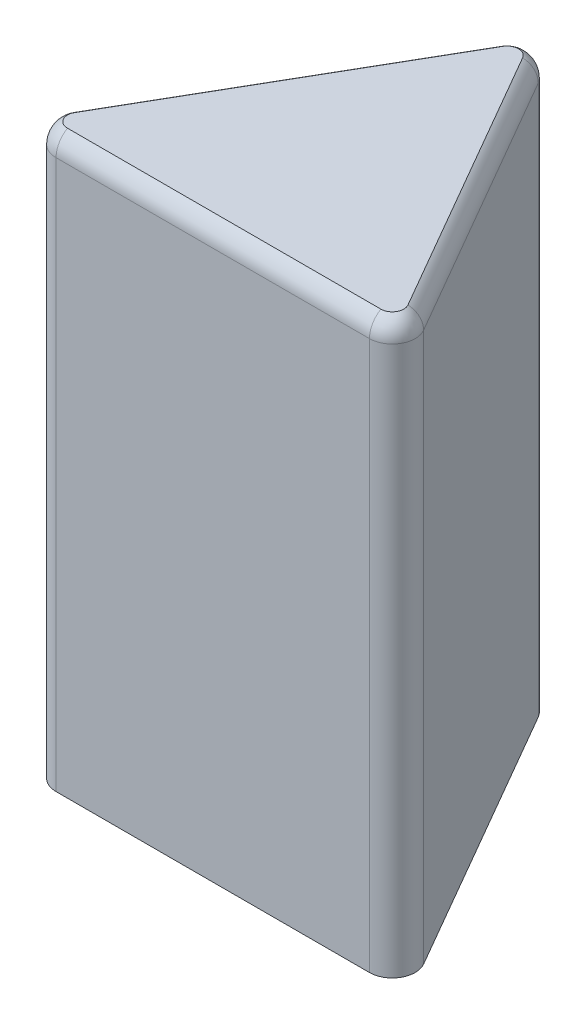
SolidWorks part; units mm, degrees
ref_plane "Alzado" through (0, 0, 0) normal (0, 0, 1) x (1, 0, 0)
ref_plane "Planta" through (0, 0, 0) normal (0, 1, 0) x (1, 0, 0)
ref_plane "Vista lateral" through (0, 0, 0) normal (1, 0, 0) x (0, 0, -1)
sketch "Croquis1" plane through (0, 0, 0) normal (0, 1, 0) x (1, 0, 0)
  line L1 (-1.55, 3.7417) -> (-1.55, 5.15)
  line L2 (-4.05, -4.05) -> (4.05, -4.05) construction
  line L3 (-0.866, 8.4097) -> (-7.716, -3.4548)
  line L4 (-6.85, -4.9548) -> (6.85, -4.9548)
  line L5 (0.866, 8.4097) -> (7.716, -3.4548)
  line L6 (-4.05, -4.05) -> (-4.05, 4.05) construction
  line L7 (-4.05, 4.05) -> (-1.55, 4.05) construction
  line L8 (4.05, -4.05) -> (4.05, 4.05) construction
  line L9 (-4.05, -4.05) -> (4.05, 4.05) construction
  line L10 (-4.05, 4.05) -> (4.05, -4.05) construction
  line L11 (-1.55, 5.15) -> (1.55, 5.15)
  line L12 (1.55, 5.15) -> (1.55, 3.7417)
  line L13 (0, 5.15) -> (0, 0) construction
  line L14 (-1.55, 4.05) -> (0, 4.05) construction
  line L15 (1.55, 4.05) -> (4.05, 4.05) construction
  line L16 (0, 4.05) -> (1.55, 4.05) construction
  circle A0 centre (0, 0) radius 9.468 construction
  arc A1 (-7.716, -3.4548) -> (-6.85, -4.9548) centre (-6.85, -3.9548) ccw
  arc A2 (0.866, 8.4097) -> (-0.866, 8.4097) centre (0, 7.9097) ccw
  arc A3 (6.85, -4.9548) -> (7.716, -3.4548) centre (6.85, -3.9548) ccw
  arc A4 (-1.55, 3.7417) -> (1.55, 3.7417) centre (0, 0) ccw
  arc A5 (2.8638, 2.8638) -> (1.55, 3.7417) centre (0, 0) ccw construction
  arc A6 (-1.55, 3.7417) -> (-2.8638, 2.8638) centre (0, 0) ccw construction
  arc A7 (-4.0115, 0.5569) -> (2.8638, 2.8638) centre (0, 0) ccw construction
  arc A8 (-2.8638, 2.8638) -> (-4.0115, 0.5569) centre (0, 0) ccw construction
  arc A9 (0, 4.05) -> (-1.55, 3.7417) centre (0, 0) ccw construction
  arc A10 (0, 4.05) -> (-1.55, 3.7417) centre (0, 0) ccw construction
  arc A11 (1.55, 3.7417) -> (0, 4.05) centre (0, 0) ccw construction
  arc A12 (1.55, 3.7417) -> (0, 4.05) centre (0, 0) ccw construction
  point P18 (0, 0)
  dimension "D2" = 1
  dimension "D3" = 13.7
  dimension "D1" = 3
  dimension "D4" = 8.1
  dimension "D5" = 9.2
  dimension "D6" = 3.1
extrude "Saliente-Extruir1" add sketch "Croquis1" along normal blind 25
chamfer "Chaflán1" distance 0.5 angle 45 4 edges at (0, 0, 4.05) (1.55, 0, -4.4458) (0, 0, -5.15) (-1.55, 0, -4.4458)
fillet "Redondeo1" radius 1 6 edges at (-7.716, 25, 4.4548) (-4.291, 25, -2.4774) (0, 25, -8.9097) (4.291, 25, -2.4774) (7.716, 25, 4.4548) (0, 25, 4.9548)
sketch "Croquis2" plane through (0, 25, 0) normal (0, 1, 0) x (1, 0, 0)
  line L19 (-6.85, -4.4548) -> (6.85, -4.4548)
  line L20 (-0.433, 8.1597) -> (-7.283, -3.7048)
  line L21 (7.283, -3.7048) -> (0.433, 8.1597)
  line L22 (-6.85, -4.4548) -> (6.85, -4.4548)
  line L23 (-0.433, 8.1597) -> (-7.283, -3.7048)
  line L24 (7.283, -3.7048) -> (0.433, 8.1597)
  arc A15 (-7.283, -3.7048) -> (-6.85, -4.4548) centre (-6.85, -3.9548) ccw
  arc A16 (6.85, -4.4548) -> (7.283, -3.7048) centre (6.85, -3.9548) ccw
  arc A17 (0.433, 8.1597) -> (-0.433, 8.1597) centre (0, 7.9097) ccw
  arc A18 (-7.283, -3.7048) -> (-6.85, -4.4548) centre (-6.85, -3.9548) ccw
  arc A19 (6.85, -4.4548) -> (7.283, -3.7048) centre (6.85, -3.9548) ccw
  arc A20 (0.433, 8.1597) -> (-0.433, 8.1597) centre (0, 7.9097) ccw
  dimension "D1" = 0.5
extrude "Saliente-Extruir2" add sketch "Croquis2" against normal blind 3
sketch "Croquis3" plane through (0, 25, 0) normal (0, 1, 0) x (1, 0, 0)
  circle A0 centre (0, 0) radius 2.475
  dimension "D1" = 4.95
extrude "Saliente-Extruir3" [suppressed] add sketch "Croquis3" along normal blind 3
fillet "Redondeo2" [suppressed] radius 2
sketch "Croquis4" plane through (0, 25, 0) normal (0, 1, 0) x (1, 0, 0)
  line L3 (-6.85, -4.4548) -> (6.85, -4.4548)
  line L4 (7.283, -3.7048) -> (0.433, 8.1597)
  line L5 (-0.433, 8.1597) -> (-7.283, -3.7048)
  line L6 (-6.85, -4.4548) -> (6.85, -4.4548)
  line L7 (7.283, -3.7048) -> (0.433, 8.1597)
  line L8 (-0.433, 8.1597) -> (-7.283, -3.7048)
  arc A3 (-7.283, -3.7048) -> (-6.85, -4.4548) centre (-6.85, -3.9548) ccw
  arc A4 (6.85, -4.4548) -> (7.283, -3.7048) centre (6.85, -3.9548) ccw
  arc A5 (0.433, 8.1597) -> (-0.433, 8.1597) centre (0, 7.9097) ccw
  arc A6 (-7.283, -3.7048) -> (-6.85, -4.4548) centre (-6.85, -3.9548) ccw
  arc A7 (6.85, -4.4548) -> (7.283, -3.7048) centre (6.85, -3.9548) ccw
  arc A8 (0.433, 8.1597) -> (-0.433, 8.1597) centre (0, 7.9097) ccw
  dimension "D1" = 0
extrude "Cortar-Extruir1" cut sketch "Croquis4" against normal up to vertex
